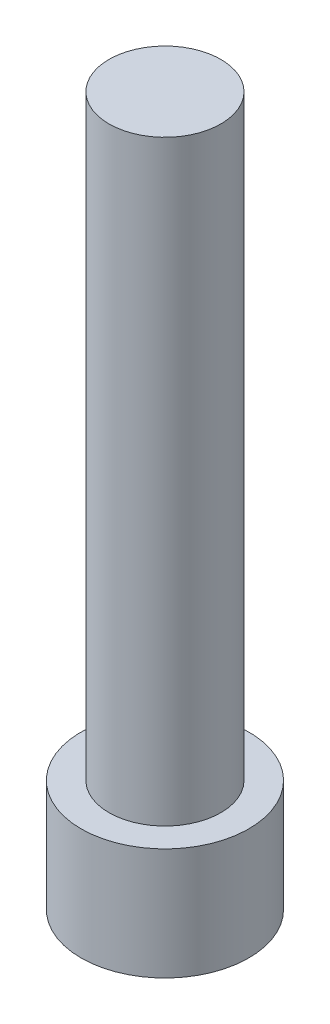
SolidWorks part; units mm, degrees
ref_plane "前视基准面" through (0, 0, 0) normal (0, 0, 1) x (1, 0, 0)
ref_plane "上视基准面" through (0, 0, 0) normal (0, 1, 0) x (1, 0, 0)
ref_plane "右视基准面" through (0, 0, 0) normal (1, 0, 0) x (0, 0, -1)
other "Configuration Table"
sketch "草图1" plane through (0, 0, 0) normal (0, 1, 0) x (1, 0, 0)
  circle A0 centre (0, 0) radius 2.25
  dimension "D1" = 4.5
extrude "凸台-拉伸1" add sketch "草图1" along normal blind 3
sketch "草图2" plane through (0, 3, 0) normal (0, 1, 0) x (1, 0, 0)
  circle A0 centre (0, 0) radius 1.5
  dimension "D1" = 3
extrude "凸台-拉伸2" add sketch "草图2" along normal blind 16
sketch "草图3" plane through (0, 0, 0) normal (0, -1, 0) x (1, 0, 0)
  line L1 (1.0917, -0.9442) -> (1.3636, 0.4733)
  line L2 (1.3636, 0.4733) -> (0.2719, 1.4175)
  line L3 (0.2719, 1.4175) -> (-1.0917, 0.9442)
  line L4 (-1.0917, 0.9442) -> (-1.3636, -0.4733)
  line L5 (-1.3636, -0.4733) -> (-0.2719, -1.4175)
  line L6 (-0.2719, -1.4175) -> (1.0917, -0.9442)
  circle A0 centre (0, 0) radius 1.25 construction
  dimension "D1" = 2.5
extrude "切除-拉伸1" cut sketch "草图3" against normal blind 1.5
